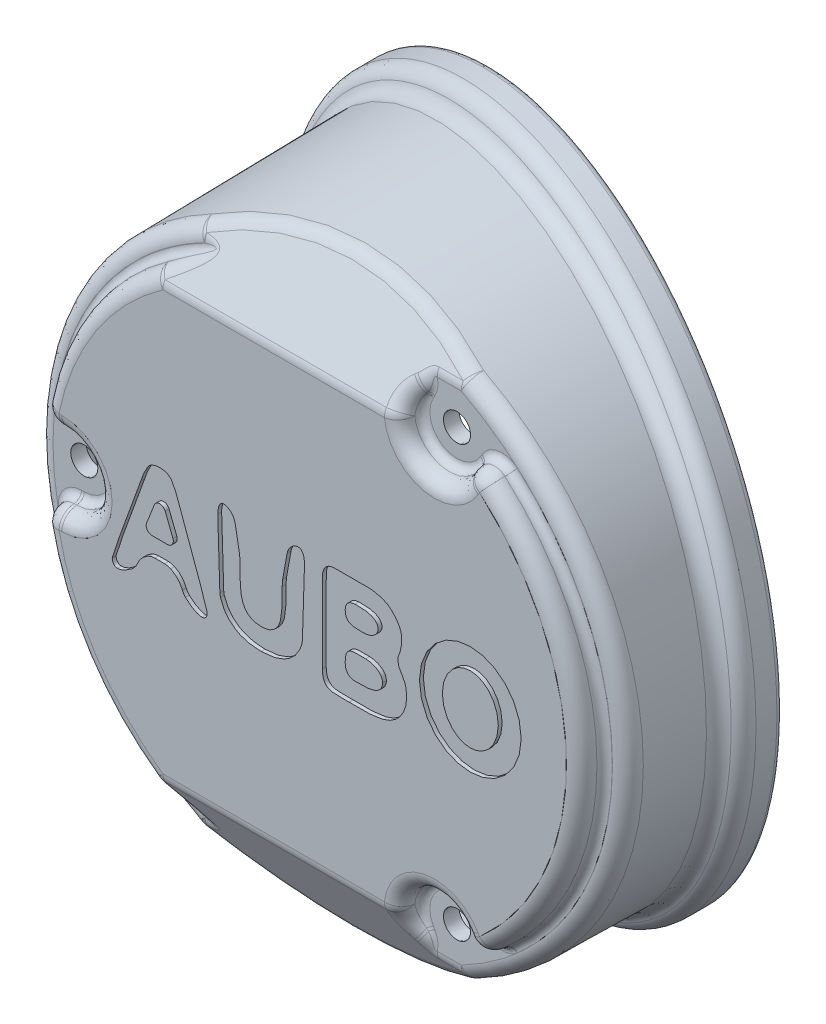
SolidWorks part; units mm, degrees
ref_plane "前视基准面" through (0, 0, 0) normal (0, 0, 1) x (1, 0, 0)
ref_plane "上视基准面" through (0, 0, 0) normal (0, 1, 0) x (1, 0, 0)
ref_plane "右视基准面" through (0, 0, 0) normal (1, 0, 0) x (0, 0, -1)
sketch "草图1" plane through (0, 0, 0) normal (0, 0, 1) x (1, 0, 0)
  circle A0 centre (0, 0) radius 38
  dimension "D1" = 76
extrude "凸台-拉伸1" add sketch "草图1" against normal blind 40.2 draft 1 contours A0
sketch "草图2" plane through (0, 0, 0) normal (0, 0, 1) x (1, 0, 0)
  circle A0 centre (0, 0) radius 35
  dimension "D1" = 70
extrude "凸台-拉伸2" add sketch "草图2" along normal blind 2.9
sketch "草图3" plane through (0, 0, 2.9) normal (0, 0, 1) x (1, 0, 0)
  line L0 (-44, 0) -> (-32, 0) construction
  line L1 (-44, 4.5) -> (-32, 4.5)
  line L2 (-44, -4.5) -> (-32, -4.5)
  arc A0 (-44, 4.5) -> (-44, -4.5) centre (-44, 0) ccw
  arc A1 (-32, -4.5) -> (-32, 4.5) centre (-32, 0) ccw
  circle A2 centre (0, 0) radius 38 construction
  point P3 (-38, 0)
  dimension "D2" = 4.5
  dimension "D1" = 32
extrude "切除-拉伸1" cut sketch "草图3" against normal blind 2.9
pattern_circular "阵列(圆周)1" count 3 over 360 about axis through (0, 0, 0) along (0, 0, 1) of "切除-拉伸1"
fillet "圆角2" radius 2 4 edges at (38, 0, 0) (35, 0, 2.9) (-17.5, 30.3109, 2.9) (-17.5, -30.3109, 2.9)
fillet "圆角4" radius 2 21 edges at (-34.2739, -4.5, 2.1415) (-32.3459, -4.5, 2.9) (-33.961, 4.5, 2.4549) (-32.3459, 4.5, 2.9) (13.2398, 31.9321, 2.1415) (12.2758, 30.2623, 2.9) (20.8776, 27.1611, 2.4549) (20.07, 25.7623, 2.9) (21.0341, -27.4321, 2.1415) (20.07, -25.7623, 2.9) (13.75, -23.8157, 2.9) (12.2758, -30.2623, 2.9) (-27.5, 0, 2.9) (13.75, 23.8157, 2.9) (13.0834, -31.6611, 2.4549) (-34.7095, -4.5, 0.45) (-34.7095, 4.5, 0.45) (13.4576, 32.3093, 0.45) (21.2519, 27.8093, 0.45) (21.2519, -27.8093, 0.45) (13.4576, -32.3093, 0.45)
fillet "圆角6" radius 1 18 edges at (-27.5, 0, 0) (-17.5, 30.3109, 0) (12.4187, 31.9753, 0) (12.1913, 30.1159, 0) (13.75, 23.8157, 0) (35, 0, 0) (21.482, -26.7426, 0) (19.9855, -25.6159, 0) (13.75, -23.8157, 0) (-17.5, -30.3109, 0) (-33.9008, -5.2327, 0) (-33.9008, 5.2327, 0) (21.482, 26.7426, 0) (12.4187, -31.9753, 0) (-32.1768, -4.5, 0) (-32.1768, 4.5, 0) (19.9855, 25.6159, 0) (12.1913, -30.1159, 0)
shell "抽壳3" thickness 2
sketch "草图5" plane through (0, 0, 0) normal (0, 1, 0) x (1, 0, 0)
  line L0 (-38.6685, 38.3) -> (45.2313, 15.8191)
  line L1 (-38.7017, 40.2) -> (-38.0343, 1.9651) construction
  line L2 (-32.3535, -2.9) -> (10.5476, -2.9) construction
  line L3 (38.7017, 40.2) -> (-38.7017, 40.2) construction
  dimension "D1" = 41.2
  dimension "D2" = 15
extrude "切除-拉伸2" cut sketch "草图5" against normal through all and the other way through all
ref_plane "基准面1" through (0, 0, -39.1) normal (0, 0, 1) x (1, 0, 0)
sketch "草图6" plane through (0, 0, -39.1) normal (0, 0, 1) x (1, 0, 0)
  ellipse E2 centre (-0.1707, 0) end of major axis (-36.6588, 0) minor radius 36.4878 construction
  ellipse E3 centre (-0.1707, 0) end of major axis (-36.6588, 0) minor radius 36.4878
  spline S0 degree 3 number of poles 134 (40.8085, 0) -> (40.8085, 0)
  spline S1 degree 3 number of poles 134 (40.8085, 0) -> (40.8085, 0)
  dimension "D1" = 2.5
extrude "凸台-拉伸3" add sketch "草图6" along normal offset from surface (6.5149 mm away) 5
sketch "草图8" plane through (0, 0, 0) normal (0, 1, 0) x (1, 0, 0)
  line L0 (-55.2145, 42.7335) -> (69.7605, 9.2465)
  line L1 (-36.6588, 37.7615) -> (36.3175, 18.2076) construction
extrude "切除-拉伸3" cut sketch "草图8" against normal through all and the other way through all
sketch "草图9" plane through (0, 0, -39.1) normal (0, 0, 1) x (1, 0, 0)
  circle A0 centre (0, 0) radius 39.35
  circle A1 centre (0, 0) radius 37.75
  dimension "D1" = 78.7
  dimension "D2" = 1.6
extrude "切除-拉伸4" cut sketch "草图9" along normal offset from surface (25.3285 mm away) 3.5
fillet "圆角7" radius 2 1 edges at (-38.5778, 0, -33.0993)
fillet "圆角8" radius 2 1 edges at (-40.0923, 9.3317, -33.5051)
fillet "圆角9" radius 0.8 2 edges at (-37.75, 0, -34.4304) (-39.35, 0, -34.8591)
fillet "圆角12" [suppressed] radius 0.4
fillet "圆角13" [suppressed] radius 0.4
sketch "草图11" plane through (0, 0, 0) normal (0, 0, 1) x (1, 0, 0)
  circle A0 centre (-32, 0) radius 1.75
  circle A1 centre (16, 27.7128) radius 1.75
  circle A2 centre (16, -27.7128) radius 1.75
  dimension "D1" = 3.5
extrude "切除-拉伸5" cut sketch "草图11" against normal blind 3
sketch "草图13" plane through (0, 0, 0) normal (1, 0, 0) x (0, 0, -1)
  line L0 (-5.046, -23.811) -> (5.1678, -41.5017)
  line L1 (-2.9, 24.769) -> (-2.9, -24.769) construction
  dimension "D1" = 30
extrude "切除-拉伸6" cut sketch "草图13" against normal through all and the other way through all flip side to cut
sketch "草图14" plane through (0, -8.1377, 14.095) normal (0, -0.5, 0.866) x (1, 0, 0)
  line L2 (9.5026, -22.3899) -> (-18.1992, -22.3899)
  line L3 (15.4574, -28.1899) -> (13.2581, -28.1899)
  line L4 (9.5026, -22.3899) -> (-18.1992, -22.3899)
  line L5 (15.4574, -28.1899) -> (13.2581, -28.1899)
  line L7 (-15.3727, -28.1899) -> (-15.4574, -28.1899)
  line L8 (-15.3727, -28.1899) -> (-15.4574, -28.1899)
  arc A1 (12.5076, -26.2566) -> (12.2437, -25.5789) centre (10.5476, -26.6297) ccw
  arc A2 (12.2328, -26.2638) -> (12.0955, -25.8695) centre (10.5476, -26.6297) ccw
  ellipse E1 centre (0, 8.9582) end of major axis (0, -34.546) minor radius 37.6739 (-12.4048, -32.1201) -> (12.4048, -32.1201) ccw
  ellipse E2 centre (0, 8.9582) end of major axis (0, -34.546) minor radius 37.6739 (-12.4048, -32.1201) -> (12.4048, -32.1201) ccw
  ellipse E4 centre (10.3877, -26.3899) end of major axis (7.8257, -22.5468) minor radius 2 (12.2437, -25.5789) -> (12.031, -25.2494) ccw
  ellipse E5 centre (10.3877, -26.3899) end of major axis (14.7875, -28.452) minor radius 1.2431 (12.0955, -25.8695) -> (11.5982, -25.6013) ccw
  spline S6 degree 3 poles (-955.4207, -276.4914) (43.6008, 14.9795) (16.2626, -30.1954) (12.9107, -28.0658) (12.8509, -27.9912) (12.7638, -27.8257) (12.7352, -27.7352) (12.6913, -27.5538) (12.6758, -27.4615) (12.6357, -27.1835) (12.617, -26.9971) (11.0904, -14.912) (-6.8251, -5.4548) (-981.1878, -138.3245) knots -4.993966 -4.993966 -4.993966 -4.993966 0.125 0.125 0.25 0.25 0.375 0.375 0.5 0.5 0.75 0.75 16.768071 16.768071 16.768071 16.768071 only from (13.2581, -28.1899) to (12.5076, -26.2566)
  spline S7 degree 3 poles (825.2477, 556.7098) (34.049, -47.2313) (19.519, -37.7062) (11.3349, -24.1325) (11.1682, -23.8482) (10.8998, -23.4341) (10.8073, -23.2985) (10.6088, -23.0381) (10.503, -22.9131) (10.2643, -22.6848) (10.1315, -22.5822) (4.2496, -19.6439) (-23.1659, -62.5305) (533.8428, -873.8855) knots -11.535864 -11.535864 -11.535864 -11.535864 0.25 0.25 0.5 0.5 0.625 0.625 0.75 0.75 0.875 0.875 5.687923 5.687923 5.687923 5.687923 only from (12.031, -25.2494) to (9.5026, -22.3899)
  spline S8 degree 3 poles (-1656.7742, 2490.2417) (17.4129, -98.9658) (-8.4145, -20.9051) (-18.6883, -22.4327) (-18.8069, -22.4613) (-19.0328, -22.5621) (-19.1377, -22.6368) (-19.2811, -22.8358) (-19.3176, -22.961) (-19.3263, -23.2073) (-19.3029, -23.3308) (-19.2301, -23.5649) (-19.1803, -23.6775) (-19.0077, -24.0046) (-18.8664, -24.2022) (-18.5587, -24.5782) (-18.3908, -24.7561) (-18.0389, -25.0955) (-17.8558, -25.2559) (8.8683, -47.0259) (140.4762, 66.8909) (-1772.8745, -2456.9929) knots -5.167517 -5.167517 -5.167517 -5.167517 0.0625 0.0625 0.125 0.125 0.1875 0.1875 0.25 0.25 0.3125 0.3125 0.375 0.375 0.5 0.5 0.625 0.625 0.75 0.75 18.348855 18.348855 18.348855 18.348855 only from (-18.1992, -22.3899) to (-16.479, -26.2566)
  spline S9 degree 3 poles (1706.2546, 2428.9712) (-107.8664, -63.3729) (-37.0951, -11.6571) (-15.5703, -26.8698) (-15.3513, -27.034) (-15.0438, -27.3089) (-14.9441, -27.4058) (-14.8135, -27.5653) (-14.773, -27.6209) (-14.7064, -27.7436) (-14.6799, -27.8106) (-14.6804, -27.9149) (-14.6882, -27.9497) (-14.721, -28.0121) (-14.745, -28.0383) (-14.8274, -28.1028) (-14.894, -28.1281) (-22.1937, -30.0813) (-40.6723, 49.4537) (622.5713, -2959.1241) knots -23.561236 -23.561236 -23.561236 -23.561236 0.25 0.25 0.5 0.5 0.625 0.625 0.6875 0.6875 0.75 0.75 0.78125 0.78125 0.8125 0.8125 0.875 0.875 7.586986 7.586986 7.586986 7.586986 only from (-16.479, -26.2566) to (-15.3727, -28.1899)
  spline S10 degree 3 poles (-68.2782, 2970.9525) (12.0729, -106.3773) (-3.1489, -26.7394) (-16.0673, -28.2311) (-16.2199, -28.2596) (-16.4344, -28.3404) (-16.5028, -28.3734) (-16.6287, -28.4614) (-16.6851, -28.5169) (-16.7643, -28.6493) (-16.7858, -28.7253) (-16.794, -28.8789) (-16.7818, -28.9563) (-16.7395, -29.1035) (-16.7091, -29.175) (-16.639, -29.3107) (-16.599, -29.3757) (-16.4693, -29.5646) (-16.37, -29.6824) (-16.0583, -30.0136) (-15.8286, -30.2102) (-15.3473, -30.579) (-15.0947, -30.7503) (-14.5808, -31.0703) (-14.3183, -31.2197) (23.7842, -51.39) (146.7711, 91.0685) (-1290.7018, -2744.1857) knots -5.177939 -5.177939 -5.177939 -5.177939 0.0625 0.0625 0.125 0.125 0.15625 0.15625 0.1875 0.1875 0.21875 0.21875 0.25 0.25 0.28125 0.28125 0.3125 0.3125 0.375 0.375 0.5 0.5 0.625 0.625 0.75 0.75 18.478882 18.478882 18.478882 18.478882 only from (-15.4574, -28.1899) to (-12.4048, -32.1201)
  spline S11 degree 3 poles (-15.4574, -28.1899) (-15.6102, -28.1899) (-15.7628, -28.1959) (-16.0673, -28.2311) (-16.2199, -28.2596) (-16.4344, -28.3404) (-16.5028, -28.3734) (-16.6287, -28.4614) (-16.6851, -28.5169) (-16.7643, -28.6493) (-16.7858, -28.7253) (-16.794, -28.8789) (-16.7818, -28.9563) (-16.7395, -29.1035) (-16.7091, -29.175) (-16.639, -29.3107) (-16.599, -29.3757) (-16.4693, -29.5646) (-16.37, -29.6824) (-16.0583, -30.0136) (-15.8286, -30.2102) (-15.3473, -30.579) (-15.0947, -30.7503) (-14.5808, -31.0703) (-14.3183, -31.2197) (-13.518, -31.6433) (-12.9676, -31.8935) (-12.4048, -32.1201) knots 0 0 0 0 0.0625 0.0625 0.125 0.125 0.15625 0.15625 0.1875 0.1875 0.21875 0.21875 0.25 0.25 0.28125 0.28125 0.3125 0.3125 0.375 0.375 0.5 0.5 0.625 0.625 0.75 0.75 1 1 1 1
  spline S12 degree 3 poles (13.2581, -28.1899) (13.1597, -28.2022) (13.0588, -28.1895) (12.8828, -28.1023) (12.811, -28.0294) (12.7023, -27.8659) (12.6624, -27.7748) (12.5954, -27.5905) (12.568, -27.4962) (12.4917, -27.2113) (12.4478, -27.0196) (12.3491, -26.6392) (12.295, -26.4503) (12.2328, -26.2638) knots 0 0 0 0 0.125 0.125 0.25 0.25 0.375 0.375 0.5 0.5 0.75 0.75 1 1 1 1
  spline S13 degree 3 poles (11.5982, -25.6013) (11.4535, -25.304) (11.321, -25.0003) (11.0644, -24.3892) (10.9408, -24.0813) (10.7366, -23.6284) (10.6654, -23.4792) (10.5079, -23.1894) (10.4219, -23.0487) (10.2188, -22.7849) (10.1024, -22.6634) (9.8947, -22.5207) (9.8219, -22.4812) (9.6682, -22.4208) (9.5863, -22.3998) (9.5026, -22.3899) knots 0 0 0 0 0.25 0.25 0.5 0.5 0.625 0.625 0.75 0.75 0.875 0.875 0.9375 0.9375 1 1 1 1
  spline S14 degree 3 poles (-18.1992, -22.3899) (-18.3221, -22.3899) (-18.4457, -22.3966) (-18.6883, -22.4327) (-18.8069, -22.4613) (-19.0328, -22.5621) (-19.1377, -22.6368) (-19.2811, -22.8358) (-19.3176, -22.961) (-19.3263, -23.2073) (-19.3029, -23.3308) (-19.2301, -23.5649) (-19.1803, -23.6775) (-19.0077, -24.0046) (-18.8664, -24.2022) (-18.5587, -24.5782) (-18.3908, -24.7561) (-18.0389, -25.0955) (-17.8558, -25.2559) (-17.2904, -25.7165) (-16.8922, -25.9962) (-16.479, -26.2566) knots 0 0 0 0 0.0625 0.0625 0.125 0.125 0.1875 0.1875 0.25 0.25 0.3125 0.3125 0.375 0.375 0.5 0.5 0.625 0.625 0.75 0.75 1 1 1 1
  spline S15 degree 3 poles (-16.479, -26.2566) (-16.2467, -26.4029) (-16.0176, -26.5536) (-15.5703, -26.8698) (-15.3513, -27.034) (-15.0438, -27.3089) (-14.9441, -27.4058) (-14.8135, -27.5653) (-14.773, -27.6209) (-14.7064, -27.7436) (-14.6799, -27.8106) (-14.6804, -27.9149) (-14.6882, -27.9497) (-14.721, -28.0121) (-14.745, -28.0383) (-14.8274, -28.1028) (-14.894, -28.1281) (-15.0961, -28.1821) (-15.2347, -28.1899) (-15.3727, -28.1899) knots 0 0 0 0 0.25 0.25 0.5 0.5 0.625 0.625 0.6875 0.6875 0.75 0.75 0.78125 0.78125 0.8125 0.8125 0.875 0.875 1 1 1 1
  spline S16 degree 3 poles (1379.1923, -2700.5562) (-154.9309, 91.218) (-24.1911, -51.5951) (14.5806, -31.081) (15.0957, -30.7705) (15.8192, -30.218) (16.054, -30.0177) (16.3676, -29.6852) (16.4661, -29.5688) (16.6406, -29.3157) (16.7169, -29.181) (16.7817, -28.9572) (16.794, -28.8799) (16.7859, -28.7256) (16.7641, -28.649) (16.6853, -28.5171) (16.629, -28.4615) (16.5023, -28.3731) (16.4324, -28.3394) (16.2169, -28.2588) (16.0641, -28.2306) (3.0426, -26.7361) (-16.7761, -107.1597) (230.7488, 2963.659) knots -17.729805 -17.729805 -17.729805 -17.729805 0.25 0.25 0.5 0.5 0.625 0.625 0.6875 0.6875 0.75 0.75 0.78125 0.78125 0.8125 0.8125 0.84375 0.84375 0.875 0.875 0.9375 0.9375 6.262229 6.262229 6.262229 6.262229 only from (12.4048, -32.1201) to (15.4574, -28.1899)
  spline S17 degree 3 poles (12.4048, -32.1201) (12.9675, -31.8935) (13.5171, -31.6437) (14.5806, -31.081) (15.0957, -30.7705) (15.8192, -30.218) (16.054, -30.0177) (16.3676, -29.6852) (16.4661, -29.5688) (16.6406, -29.3157) (16.7169, -29.181) (16.7817, -28.9572) (16.794, -28.8799) (16.7859, -28.7256) (16.7641, -28.649) (16.6853, -28.5171) (16.629, -28.4615) (16.5023, -28.3731) (16.4324, -28.3394) (16.2169, -28.2588) (16.0641, -28.2306) (15.762, -28.196) (15.61, -28.1899) (15.4574, -28.1899) knots 0 0 0 0 0.25 0.25 0.5 0.5 0.625 0.625 0.6875 0.6875 0.75 0.75 0.78125 0.78125 0.8125 0.8125 0.84375 0.84375 0.875 0.875 0.9375 0.9375 1 1 1 1
  dimension "D1" = 0
extrude "凸台-拉伸4" add sketch "草图14" against normal blind 2
fillet "圆角10" radius 0.5 1 edges at (0, -36.0755, -4.3443)
mirror "镜向1" about plane through (0, 0, 0) normal (0, 1, 0) of "凸台-拉伸4", "圆角10", "切除-拉伸6"
fillet "圆角11" radius 2 22 edges at (10.2922, 27.8107, 2.7368) (12.7631, 32.2213, 0.1903) (16.7893, 33.0724, -0.3011) (-16.763, 32.9619, -0.2373) (0, 38.0555, -3.1781) (-14.7054, 32.3712, 0.1038) (-19.2607, 27.9027, 2.6836) (10.2922, -27.8107, 2.7368) (12.7631, -32.2213, 0.1903) (-15.415, 32.5509, 0) (12.1389, 30.1463, 1.3883) (12.1389, -30.1463, 1.3883)
sketch "草图20" plane through (0, 0, 2.9) normal (0, 0, 1) x (1, 0, 0)
  line L0 (0, 1.3574) -> (0, -36.0196) construction
  line L1 (-32, 0) -> (48.4604, 0) construction
  dimension "D1" = 6.5
sketch_block_instance "块1-1"
sketch_block "块2"
sketch_block_instance "块1-3"
sketch_block "块1"
extrude "切除-拉伸8" cut sketch "草图20" against normal blind 0.5
fillet "圆角14" radius 0.5 20 edges at (9.8154, -28.7892, -0.1376) (11.294, -30.636, -1.2038) (12.5887, -31.7786, -1.8635) (14.698, -32.015, -2) (16.657, -31.8703, -2) (36.0346, 0, -2) (-36.0346, 0, -2) (16.571, 31.898, -2) (14.698, 32.015, -2) (12.6196, 31.7968, -1.874) (11.294, 30.636, -1.2038) (-14.4538, -31.2142, -1.5376) (-16.3338, -31.9608, -1.9981) (-16.2239, 31.9821, -1.9969) (-4.7224, -26.9921, 0.9) (9.6506, 28.3025, 0.1434) (-14.529, 31.4745, -1.6879) (-4.7224, 26.9921, 0.9)
sketch "草图21" plane through (0, 0, 0.9) normal (0, 0, -1) x (-1, 0, 0)
  line L0 (-21.8059, -24.919) -> (-21.8059, -24.619) construction
  line L1 (-21.8059, -24.919) -> (-21.8059, -24.619)
  arc A0 (-21.8059, -24.919) -> (-21.8059, -24.619) centre (-21.8059, -24.769) ccw
  dimension "D1" = 0.3
revolve "旋转3" add sketch "草图21" angle 360 about L0
sketch "草图22" plane through (0, 0, 0.9) normal (0, 0, -1) x (-1, 0, 0)
  line L0 (32.3535, -6.35) -> (32.3535, -6.65) construction
  line L1 (32.3535, -6.35) -> (32.3535, -6.65)
  arc A0 (32.3535, -6.35) -> (32.3535, -6.65) centre (32.3535, -6.5) ccw
  dimension "D1" = 0.3
revolve "旋转4" add sketch "草图22" angle 360 about L0
mirror "镜向2" about plane through (0, 0, 0) normal (0, 1, 0) of "旋转4", "旋转3"
fillet "圆角15" radius 0.5 14 edges at (9.1344, 27.081, 0.8476) (9.1344, -27.081, 0.8476) (15.0947, 21.2762, 0.9) (15.0947, -21.2762, 0.9) (33, 0, 0.9) (21.68, 24.5509, 0.9) (21.68, -24.5509, 0.9) (-32.1018, -6.5, 0.9) (-32.1018, 6.5, 0.9) (-27.8611, -17.685, 0.9) (-25.5, 0, 0.9) (-27.8611, 17.685, 0.9)
fillet "圆角16" radius 0.8 1 edges at (-40.0923, 9.3317, -38.6815)
